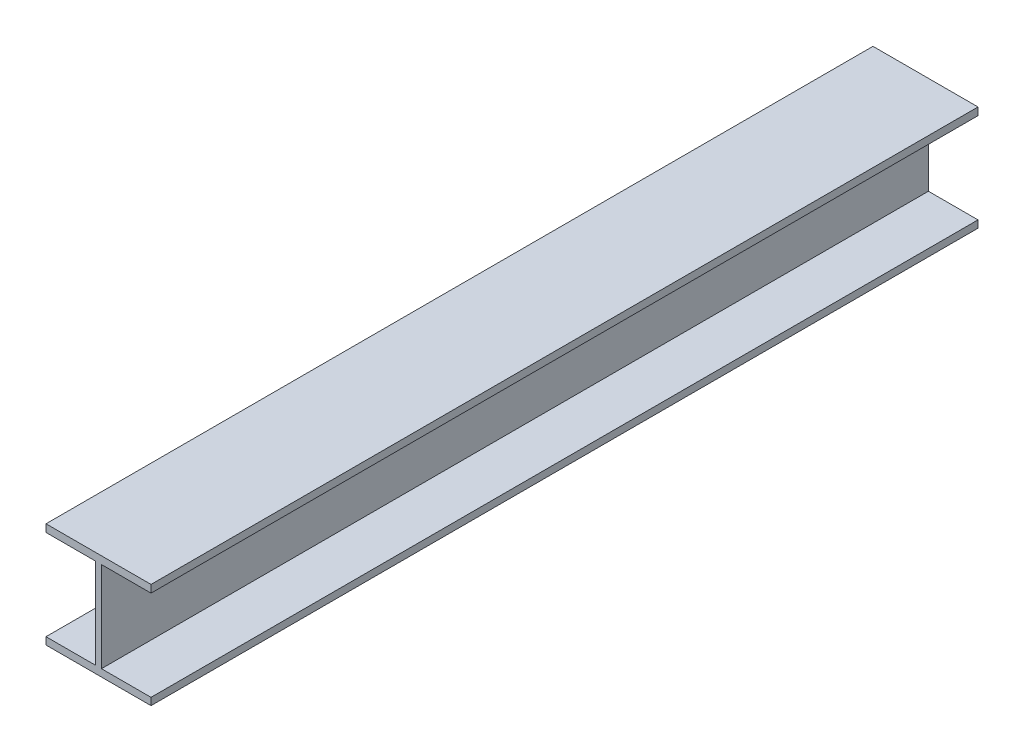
SolidWorks part; units mm, degrees
ref_plane "Front Plane" through (0, 0, 0) normal (0, 0, 1) x (1, 0, 0)
ref_plane "Top Plane" through (0, 0, 0) normal (0, 1, 0) x (1, 0, 0)
ref_plane "Right Plane" through (0, 0, 0) normal (1, 0, 0) x (0, 0, -1)
sketch "Sketch1" plane through (0, 0, 0) normal (0, 0, 1) x (1, 0, 0)
  line L0 (63.5, 54.36) -> (3.555, 54.36)
  line L1 (-63.5, -63.5) -> (63.5, -63.5)
  line L2 (-63.5, -63.5) -> (-63.5, -54.74)
  line L3 (-63.5, 63.5) -> (63.5, 63.5)
  line L4 (63.5, -63.5) -> (63.5, -54.74)
  line L5 (-63.5, -63.5) -> (63.5, 63.5) construction
  line L6 (-63.5, 63.5) -> (63.5, -63.5) construction
  line L7 (-63.5, -54.74) -> (-3.555, -54.74)
  line L8 (-3.555, 54.36) -> (-3.555, -54.74)
  line L9 (3.555, -54.74) -> (3.555, 54.36)
  line L10 (-3.555, 54.36) -> (-63.5, 54.36)
  line L11 (3.555, -54.74) -> (63.5, -54.74)
  line L12 (-63.5, 54.36) -> (-63.5, 63.5)
  line L13 (63.5, 54.36) -> (63.5, 63.5)
  point P0 (0, 0)
  dimension "D1" = 127
  dimension "D2" = 127
  dimension "D3" = 8.76
  dimension "D4" = 9.14
  dimension "D5" = 7.11
  dimension "D6" = 3.555
extrude "Boss-Extrude1" add sketch "Sketch1" along normal blind 1000
